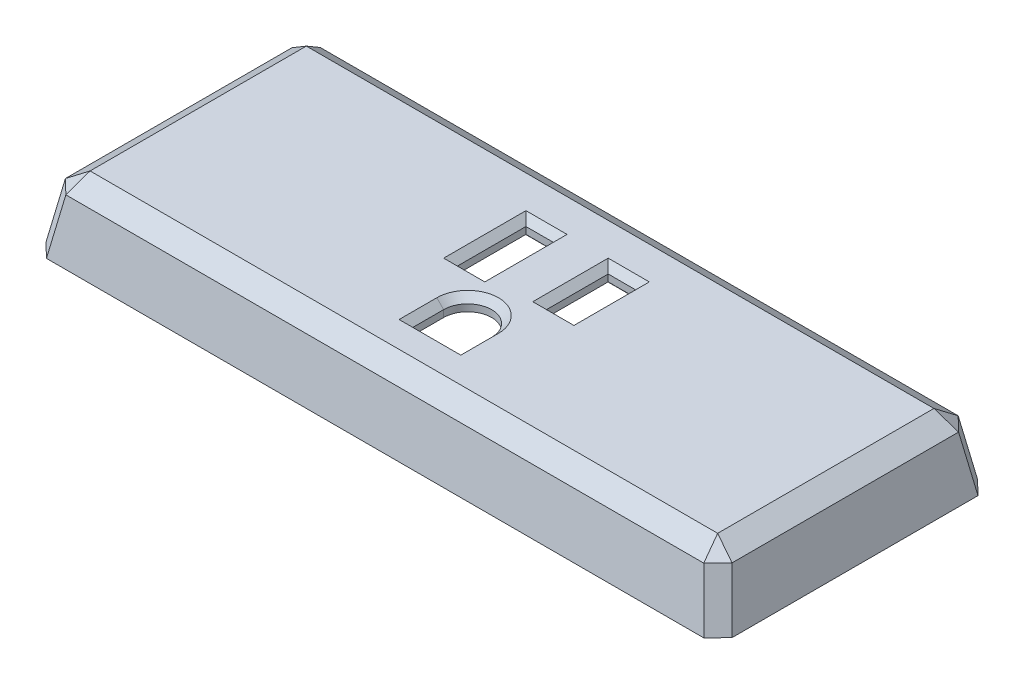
SolidWorks part; units mm, degrees
ref_plane "Front" through (0, 0, 0) normal (0, 0, 1) x (1, 0, 0)
ref_plane "Top" through (0, 0, 0) normal (0, 1, 0) x (1, 0, 0)
ref_plane "Right" through (0, 0, 0) normal (1, 0, 0) x (0, 0, -1)
sketch "Sketch2" plane through (0, 0, 0) normal (0, 1, 0) x (1, 0, 0)
  line L0 (50, -20) -> (-50, 20) construction
  line L1 (-50, -20) -> (50, -20)
  line L2 (-50, -20) -> (-50, 20)
  line L3 (-50, 20) -> (50, 20)
  line L4 (50, -20) -> (50, 20)
  dimension "D1" = 100
  dimension "D2" = 40
extrude "Extrude1" add sketch "Sketch2" along normal blind 10 draft 10
chamfer "Chamfer1" distance 2 angle 45 8 edges at (0, 10, -18.2367) (48.2367, 10, 0) (0, 10, 18.2367) (-48.2367, 10, 0) (-49.1184, 5, -19.1184) (49.1184, 5, -19.1184) (49.1184, 5, 19.1184) (-49.1184, 5, 19.1184)
shell "Shell1" thickness 2
sketch "Sketch22" plane through (-3.352, 10, 15.9706) normal (0, 1, 0) x (1, 0, 0)
  line L0 (-0.616, 25.9706) -> (7.384, 25.9706) construction
  line L1 (-4.616, 25.9706) -> (-0.616, 25.9706)
  line L2 (-4.616, 25.9706) -> (-4.616, 15.9706)
  line L3 (-4.616, 15.9706) -> (-0.616, 15.9706)
  line L4 (-0.616, 25.9706) -> (-0.616, 15.9706)
  line L5 (7.384, 25.9706) -> (11.384, 25.9706)
  line L6 (7.384, 25.9706) -> (7.384, 16.9706)
  line L7 (7.384, 16.9706) -> (11.384, 16.9706)
  line L8 (11.384, 25.9706) -> (11.384, 16.9706)
  line L9 (3.384, -4.0294) -> (3.384, 25.9706) construction
  line L10 (-0.116, 4.9706) -> (6.884, 4.9706)
  line L11 (6.884, 4.9706) -> (6.884, 9.4706)
  line L12 (-0.116, 4.9706) -> (-0.116, 9.4706)
  line L15 (-44.554, -4.0294) -> (51.322, -4.0294) construction
  arc A0 (6.884, 9.4706) -> (-0.116, 9.4706) centre (3.384, 9.4706) ccw
  dimension "D7" = 8
  dimension "D1" = 8
  dimension "D2" = 4
  dimension "D3" = 10
  dimension "D4" = 9
  dimension "D5" = 11
  dimension "D6" = 7
  dimension "D8" = 30
extrude "Cut-Extrude1" cut sketch "Sketch22" against normal through all
chamfer "Chamfer12" distance 1 angle 45 12 edges at (-3.468, 10, 8.75) (0.032, 10, 11) (3.532, 10, 8.75) (0.032, 10, 3) (8.032, 10, -5.5) (6.032, 10, -10) (4.032, 10, -5.5) (6.032, 10, -1) (-3.968, 10, -5) (-5.968, 10, -10) (-7.968, 10, -5) (-5.968, 10, 0)
other "3_Prong_Plug2"
